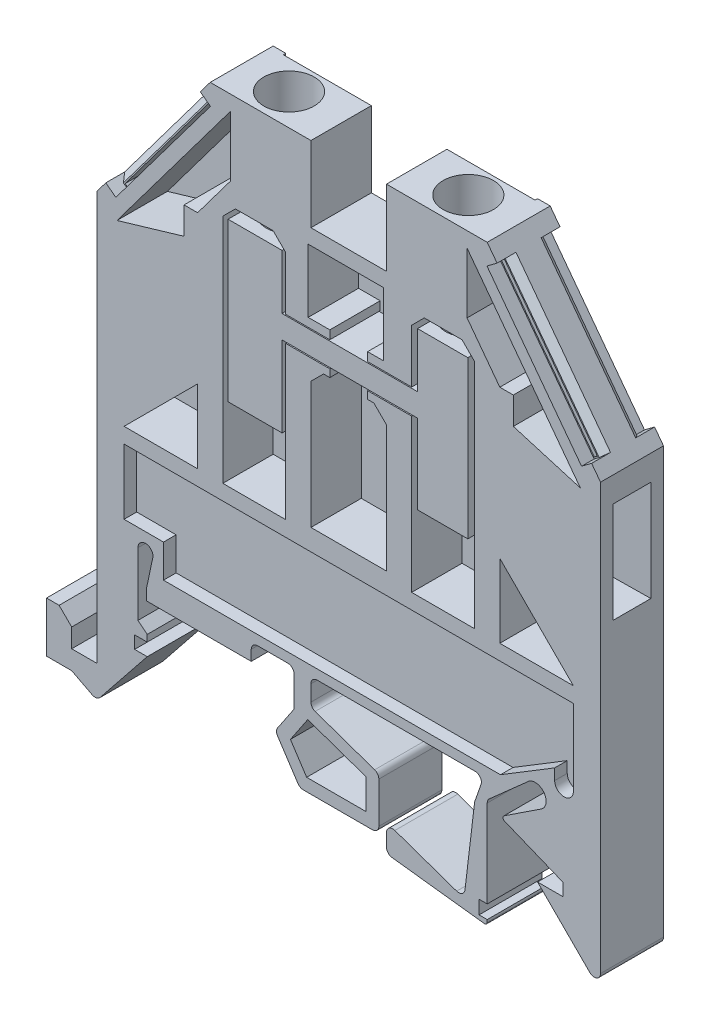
SolidWorks part; units mm, degrees
ref_plane "Front Plane" through (0, 0, 0) normal (0, 0, 1) x (1, 0, 0)
ref_plane "Top Plane" through (0, 0, 0) normal (0, 1, 0) x (1, 0, 0)
ref_plane "Right Plane" through (0, 0, 0) normal (1, 0, 0) x (0, 0, -1)
sketch "Sketch2" plane through (0, 0, 0) normal (0, 0, 1) x (1, 0, 0)
  line L0 (0, 2.5417) -> (0, 35)
  line L1 (0, 2.5417) -> (-2, 2.5417)
  line L2 (-2, 2.5417) -> (-2, 4.0417)
  line L3 (-2, 4.0417) -> (-3, 5.0334)
  line L4 (-3, 5.0334) -> (-4, 5.0334)
  line L5 (0, 35) -> (9, 47)
  line L6 (-4, 5.0334) -> (-4, 1.0334)
  line L7 (0.256, 0.3199) -> (4, 5)
  line L8 (-4, 1.0334) -> (-2, 1.0334)
  line L9 (-2, 1.0334) -> (-0.364, 0.1881)
  line L10 (17, 47) -> (9, 47)
  line L11 (4, 5) -> (3, 5)
  line L12 (20, -16) -> (20, 41) construction
  line L13 (3, 5) -> (3, 6)
  line L14 (17, 47) -> (17, 41)
  line L15 (3, 6) -> (4, 6)
  line L16 (40, 35) -> (31, 47)
  line L17 (4, 6) -> (4, 6.5321)
  line L18 (4, 6.5321) -> (3.2603, 7.1239)
  line L19 (3.2603, 7.1239) -> (3.2603, 12.1239)
  line L20 (35, 5) -> (39.1464, 0.8536)
  line L21 (40, 1.2071) -> (40, 35)
  line L22 (31, 47) -> (23, 47)
  line L23 (4.46, 12.1239) -> (3.9301, 9.6125)
  line L24 (17, 41) -> (23, 41)
  line L25 (23, 41) -> (23, 47)
  line L26 (12.2589, 9.6338) -> (12.2589, 8.8035)
  line L27 (12.2589, 8.8035) -> (3.9301, 8.8035)
  line L28 (3.9301, 8.8035) -> (3.9301, 9.6125)
  line L34 (37, 6) -> (32.3786, 7.8746)
  line L35 (35, 5) -> (37, 5)
  line L36 (37, 5) -> (37, 6)
  line L37 (32.3438, 8.2269) -> (35.2891, 10.1665)
  line L39 (34.3364, 11.6133) -> (31.1682, 8.8035)
  line L40 (31, 8.4294) -> (31, 1.4913)
  line L41 (31, 1.4913) -> (30.3546, 1.4913)
  line L42 (30.3546, 1.4913) -> (30.3546, 0.4168)
  line L43 (30.3546, 0.4168) -> (31, 0.4168)
  line L44 (31, 0.4168) -> (31, 0.2253)
  line L45 (30.7763, 0.0267) -> (23.4408, 0.9015)
  line L46 (23, 1.398) -> (23, 2.406)
  line L47 (23.6652, 2.8779) -> (28.5729, 1.1599)
  line L48 (29.2346, 1.5726) -> (30.0032, 8.0176)
  line L49 (30.0032, 8.0176) -> (30.5111, 9.4686)
  line L50 (30.0392, 10.1338) -> (17.5, 10.1338)
  line L51 (17, 9.6338) -> (17, 8.3723)
  line L52 (17.3348, 7.9004) -> (22.0586, 6.2468)
  line L53 (22.3934, 5.7749) -> (22.3934, 2.5324)
  line L54 (21.8934, 2.0324) -> (16.3919, 2.0324)
  line L55 (15.9743, 2.2574) -> (14.3511, 4.7222)
  line L56 (14.3537, 5.2761) -> (15.664, 7.2264)
  line L57 (15.664, 7.2264) -> (15.664, 9.6338)
  line L58 (15.164, 10.1338) -> (12.7589, 10.1338)
  arc A0 (4.46, 12.1239) -> (3.2603, 12.1239) centre (3.8601, 12.1239) ccw
  arc A1 (35.2891, 10.1665) -> (34.3364, 11.6133) centre (34.8128, 10.8899) ccw
  arc A2 (32.3786, 7.8746) -> (32.3438, 8.2269) centre (32.4538, 8.0599) cw
  arc A3 (31, 0.2253) -> (30.7763, 0.0267) centre (30.8, 0.2253) cw
  arc A4 (23.4408, 0.9015) -> (23, 1.398) centre (23.5, 1.398) cw
  arc A5 (23, 2.406) -> (23.6652, 2.8779) centre (23.5, 2.406) cw
  arc A6 (28.5729, 1.1599) -> (29.2346, 1.5726) centre (28.7381, 1.6318) ccw
  arc A7 (30.5111, 9.4686) -> (30.0392, 10.1338) centre (30.0392, 9.6338) ccw
  arc A8 (31.1682, 8.8035) -> (31, 8.4294) centre (31.5, 8.4294) ccw
  arc A9 (22.0586, 6.2468) -> (22.3934, 5.7749) centre (21.8934, 5.7749) cw
  arc A10 (22.3934, 2.5324) -> (21.8934, 2.0324) centre (21.8934, 2.5324) cw
  arc A11 (16.3919, 2.0324) -> (15.9743, 2.2574) centre (16.3919, 2.5324) cw
  arc A12 (14.3511, 4.7222) -> (14.3537, 5.2761) centre (14.7687, 4.9972) cw
  arc A13 (17, 8.3723) -> (17.3348, 7.9004) centre (17.5, 8.3723) ccw
  arc A14 (15.664, 9.6338) -> (15.164, 10.1338) centre (15.164, 9.6338) ccw
  arc A15 (17.5, 10.1338) -> (17, 9.6338) centre (17.5, 9.6338) ccw
  arc A16 (12.7589, 10.1338) -> (12.2589, 9.6338) centre (12.7589, 9.6338) ccw
  arc A17 (-0.364, 0.1881) -> (0.256, 0.3199) centre (-0.1345, 0.6323) ccw
  arc A18 (39.1464, 0.8536) -> (40, 1.2071) centre (39.5, 1.2071) ccw
  point P91 (0, 0)
  point P94 (40, 0)
  dimension "D21" = 0.2
  dimension "D22" = 0.5
  dimension "D23" = 0.5
  dimension "D24" = 0.5
  dimension "D25" = 0.5
  dimension "D2" = 8
  dimension "D3" = 12
  dimension "D4" = 20
  dimension "D5" = 5
  dimension "D6" = 2
  dimension "D7" = 4
  dimension "D8" = 1
  dimension "D9" = 2
  dimension "D10" = 4
  dimension "D11" = 5
  dimension "D12" = 5
  dimension "D13" = 6
  dimension "D14" = 3
  dimension "D15" = 6
  dimension "D16" = 4
  dimension "D17" = 17
  dimension "D18" = 17
  dimension "D19" = 5
  dimension "D20" = 1
extrude "Extrude1" add sketch "Sketch2" along normal blind 5
sketch "Sketch5" plane through (0, 0, 5) normal (0, 0, 1) x (1, 0, 0)
  line L0 (15, 38.2967) -> (14, 39.2967)
  line L1 (11, 39.2967) -> (10, 38.2967)
  line L2 (21.5, 34.7279) -> (22.7826, 34.7279)
  line L3 (26, 39.2967) -> (25, 38.2967)
  line L4 (29, 39.2967) -> (30, 38.2967)
  line L5 (18.5, 31.4439) -> (18.5, 32.0439)
  line L6 (21.5, 34.7279) -> (21.5, 34.0439)
  line L7 (21.5, 31.4439) -> (22, 31.4439)
  line L8 (18.5, 34.0439) -> (15, 34.0439)
  line L9 (18.5, 32.0439) -> (15, 32.0439)
  line L10 (18.5, 34.0439) -> (18.5, 34.7279)
  line L11 (15, 32.0439) -> (15, 19.921)
  line L12 (21.5, 32.0439) -> (25, 32.0439)
  line L13 (21.5, 34.0439) -> (25, 34.0439)
  line L14 (8, 19.921) -> (2.1599, 19.921)
  line L15 (16.7826, 39.7634) -> (22.7826, 39.7634)
  line L16 (16.7826, 39.7634) -> (16.7826, 34.7279)
  line L17 (16.7826, 34.7279) -> (18.5, 34.7279)
  line L18 (22.7826, 39.7634) -> (22.7826, 34.7279)
  line L19 (18, 31.4439) -> (18.5, 31.4439)
  line L20 (17, 30.4439) -> (17, 20.3877)
  line L21 (17, 20.3877) -> (23, 20.3877)
  line L22 (23, 30.4439) -> (23, 20.3877)
  line L23 (14, 39.2967) -> (11, 39.2967)
  line L24 (15, 38.2967) -> (15, 34.0439)
  line L25 (15, 19.921) -> (10, 19.921)
  line L26 (10, 38.2967) -> (10, 19.921)
  line L27 (2.1599, 19.921) -> (8, 25.7612)
  line L28 (8, 25.7612) -> (8, 19.921)
  line L29 (20, 41) -> (20, 10.1338) construction
  line L30 (23, 41) -> (17, 41) construction
  line L31 (17.5, 10.1338) -> (30.0392, 10.1338) construction
  line L32 (32, 25.7612) -> (32, 19.921)
  line L33 (37.8401, 19.921) -> (32, 25.7612)
  line L34 (30, 38.2967) -> (30, 19.921)
  line L35 (25, 19.921) -> (30, 19.921)
  line L36 (25, 38.2967) -> (25, 34.0439)
  line L37 (26, 39.2967) -> (29, 39.2967)
  line L38 (32, 19.921) -> (37.8401, 19.921)
  line L39 (25, 32.0439) -> (25, 19.921)
  line L40 (21.5, 32.0439) -> (21.5, 31.4439)
  line L41 (17, 30.4439) -> (18, 31.4439)
  line L42 (22, 31.4439) -> (23, 30.4439)
  line L44 (10.6, 45.8) -> (10.6, 41)
  line L45 (10.6, 45.8) -> (1.6, 33.8)
  line L46 (10.6, 41) -> (8, 37.5333)
  line L47 (8, 37.5333) -> (6.9248, 37.5333)
  line L48 (6.9248, 37.5333) -> (6.9248, 35.3744)
  line L49 (6.9248, 35.3744) -> (1.6, 33.8)
  line L50 (33.0752, 35.3744) -> (38.4, 33.8)
  line L51 (33.0752, 37.5333) -> (33.0752, 35.3744)
  line L52 (32, 37.5333) -> (33.0752, 37.5333)
  line L53 (29.4, 41) -> (32, 37.5333)
  line L54 (29.4, 45.8) -> (38.4, 33.8)
  line L55 (29.4, 45.8) -> (29.4, 41)
  point P15 (17, 31.4439)
  point P18 (23, 31.4439)
  point P19 (15, 39.2967)
  point P22 (10, 39.2967)
  point P35 (30, 39.2967)
  point P38 (25, 39.2967)
extrude "Extrude2" cut sketch "Sketch5" against normal blind 4
sketch "Sketch6" plane through (0, 0, 5) normal (0, 0, 1) x (1, 0, 0)
  line L0 (2.1599, 18.7051) -> (37.8401, 18.7051)
  line L1 (37.8401, 18.7051) -> (37.8401, 12.6536)
  line L3 (36.3561, 12.6536) -> (36.3561, 13.5277)
  line L4 (36.3561, 13.5277) -> (32.0528, 10.9054)
  line L5 (32.0528, 10.9054) -> (5.2919, 10.9054)
  line L6 (5.2919, 10.9054) -> (5.2919, 13.5277)
  line L7 (5.2919, 13.5277) -> (2.1599, 13.5277)
  line L8 (2.1599, 13.5277) -> (2.1599, 18.7051)
  arc A0 (36.3561, 12.6536) -> (37.8401, 12.6536) centre (37.0981, 12.6536) ccw
extrude "Extrude3" cut sketch "Sketch6" against normal blind 1
sketch "Sketch7" plane through (0, 0, 0) normal (-1, 0, 0) x (0, 0, 1)
  line L0 (5, 35) -> (0, 35) construction
  line L1 (1, 33) -> (4, 33)
  line L2 (1, 33) -> (1, 25)
  line L3 (1, 25) -> (4, 25)
  line L4 (4, 33) -> (4, 25)
  line L5 (5, 35) -> (5, 2.5417) construction
  dimension "D1" = 8
  dimension "D2" = 2
  dimension "D3" = 3
  dimension "D4" = 1
sketch "Sketch8" plane through (10, 0, 0) normal (1, 0, 0) x (0, 0, -1)
  line L0 (0, 1.2071) -> (0, 35) construction
  line L1 (-3.5, 32.2675) -> (-2, 32.2675)
  line L2 (-3.5, 32.2675) -> (-3.5, 25.8536)
  line L3 (-3.5, 25.8536) -> (-2, 25.8536)
  line L4 (-2, 32.2675) -> (-2, 25.8536)
  dimension "D1" = 2
  dimension "D2" = 1.5
loft "Cut-Loft1" cut profiles "Sketch7", "Sketch8"
sketch "Sketch10" plane through (0, 0, 1) normal (0, 0, 1) x (1, 0, 0)
  line L0 (25.4674, 32.138) -> (25.4674, 25.8312)
  line L1 (10.4198, 38.2967) -> (14.7073, 38.2967)
  line L2 (10.4198, 38.2967) -> (10.4198, 25.74)
  line L3 (10.4198, 25.74) -> (14.7073, 25.74)
  line L4 (14.7073, 38.2967) -> (14.7073, 33.9557)
  line L5 (14.7073, 33.9557) -> (25.4674, 33.9557)
  line L7 (14.7073, 32.138) -> (25.4674, 32.138)
  line L8 (14.7073, 32.138) -> (14.7073, 25.74)
  line L9 (25.4674, 38.2967) -> (29.4612, 38.2967)
  line L10 (25.4674, 38.2967) -> (25.4674, 33.9557)
  line L11 (25.4674, 25.8312) -> (29.4612, 25.8312)
  line L12 (29.4612, 38.2967) -> (29.4612, 25.8312)
extrude "Extrude4" add sketch "Sketch10" along normal blind 4
sketch "Sketch11" plane through (0, 47, 0) normal (0, 1, 0) x (1, 0, 0)
  circle A0 centre (12.7589, -2.5) radius 2
  circle A1 centre (27, -2.5) radius 2
extrude "Extrude5" cut sketch "Sketch11" against normal blind 8.5
sketch "Sketch12" plane through (0, 38.5, 0) normal (0, 1, 0) x (1, 0, 0)
  circle A0 centre (12.7589, -2.5) radius 1.8
  circle A1 centre (27, -2.5) radius 1.8
extrude "Extrude6" add sketch "Sketch12" along normal blind 2
sketch "Sketch13" plane through (0, 40.5, 0) normal (0, 1, 0) x (1, 0, 0)
  line L0 (12.4618, -0.7247) -> (12.4618, -4.2753)
  line L1 (13.0561, -0.7247) -> (13.0561, -4.2753)
  line L2 (20, 0) -> (20, -5) construction
  line L3 (23, 0) -> (17, 0) construction
  line L4 (23, -5) -> (17, -5) construction
  line L5 (26.9439, -0.7247) -> (26.9439, -4.2753)
  line L6 (27.5382, -0.7247) -> (27.5382, -4.2753)
  arc A0 (13.7539, -1) -> (11.7639, -1) centre (12.7589, -2.5) ccw construction
  circle A1 centre (12.7589, -2.5) radius 1.8 construction
  arc A2 (13.0561, -0.7247) -> (12.4618, -0.7247) centre (12.7589, -2.5) ccw
  arc A3 (13.0561, -4.2753) -> (12.4618, -4.2753) centre (12.7589, -3.1721) cw
  arc A4 (26.9439, -4.2753) -> (27.5382, -4.2753) centre (27.2411, -3.1721) ccw
  arc A5 (26.9439, -0.7247) -> (27.5382, -0.7247) centre (27.2411, -2.5) cw
extrude "Extrude7" cut sketch "Sketch13" against normal blind 1
sketch "Sketch14" plane through (-16.8, 12.6, 0) normal (-0.8, 0.6, 0) x (0, 0, 1)
  line L0 (0, 43) -> (0, 28) construction
  line L1 (0, 41.6959) -> (1, 41.6959)
  line L2 (0, 41.6959) -> (0, 29.1789)
  line L3 (0, 29.1789) -> (1, 29.1789)
  line L4 (1, 41.6959) -> (1, 29.1789)
  line L5 (5, 43) -> (5, 28) construction
  line L6 (5, 41.6959) -> (4, 41.6959)
  line L7 (5, 41.6959) -> (5, 29.1789)
  line L8 (5, 29.1789) -> (4, 29.1789)
  line L9 (4, 41.6959) -> (4, 29.1789)
  dimension "D1" = 1
  dimension "D2" = 1
extrude "Extrude8" cut sketch "Sketch14" against normal blind 1
chamfer "Chamfer1" distance 0.5 angle 45 2 edges at (4.4624, 40.9499, 1) (4.4624, 40.9499, 4)
sketch "Sketch17" plane through (0, 0, 4) normal (0, 0, 1) x (1, 0, 0)
  line L0 (8.6375, 45.5167) -> (1.2473, 35.6631)
  line L1 (1.2473, 35.6631) -> (1.4873, 35.4831)
  line L2 (1.4873, 35.4831) -> (8.8775, 45.3367)
  line L3 (8.8775, 45.3367) -> (8.6375, 45.5167)
extrude "Extrude9" cut sketch "Sketch17" against normal blind 1
sketch "Sketch18" plane through (0, 0, 1) normal (0, 0, -1) x (-1, 0, 0)
  line L0 (-1.2473, 35.6631) -> (-8.6375, 45.5167)
  line L1 (-8.6375, 45.5167) -> (-8.8775, 45.3367)
  line L2 (-8.8775, 45.3367) -> (-1.4873, 35.4831)
  line L3 (-1.4873, 35.4831) -> (-1.2473, 35.6631)
extrude "Extrude10" cut sketch "Sketch18" against normal blind 1
sketch "Sketch19" plane through (0, 0, 5) normal (0, 0, 1) x (1, 0, 0)
  line L5 (16.4941, 6.6688) -> (16.7478, 7.0464)
  line L10 (16.4941, 6.6688) -> (15.3692, 4.9945)
  line L11 (15.3692, 4.9945) -> (16.6613, 3.0324)
  line L12 (16.6613, 3.0324) -> (21.3934, 3.0324)
  line L13 (21.3934, 3.0324) -> (21.3934, 5.4201)
  line L14 (21.3934, 5.4201) -> (16.7478, 7.0464)
extrude "Extrude11" cut sketch "Sketch19" against normal through all
ref_plane "Plane1" through (20, 0, 0) normal (-1, 0, 0) x (0, 0, 1)
mirror "Mirror4" about plane through (20, 0, 0) normal (-1, 0, 0) of "Cut-Loft1", "Extrude8", "Extrude9", "Extrude10"
chamfer "Chamfer2" distance 0.5 angle 45 2 edges at (35.5376, 40.9499, 1) (35.5376, 40.9499, 4)
sketch "Sketch20" plane through (0, 0, 0) normal (0, 0, -1) x (-1, 0, 0)
  line L0 (-37.8401, 18.7051) -> (-2.1599, 18.7051)
  line L1 (-2.1599, 18.7051) -> (-2.1599, 13.5277)
  line L2 (-2.1599, 13.5277) -> (-5.2919, 13.5277)
  line L3 (-5.2919, 13.5277) -> (-5.2919, 10.9054)
  line L4 (-5.2919, 10.9054) -> (-32.0528, 10.9054)
  line L5 (-32.0528, 10.9054) -> (-36.3561, 13.5277)
  line L6 (-36.3561, 13.5277) -> (-36.3561, 12.6536)
  line L8 (-37.8401, 12.6536) -> (-37.8401, 18.7051)
  arc A0 (-36.3561, 12.6536) -> (-37.8401, 12.6536) centre (-37.0981, 12.6536) cw
extrude "Extrude12" cut sketch "Sketch20" against normal blind 1
sketch "Sketch21" plane through (0, 0, 0) normal (0, 0, -1) x (-1, 0, 0)
  line L0 (-30, 47) -> (-30, 37)
  line L1 (-31, 47) -> (-23, 47) construction
  line L2 (-30, 37) -> (-25, 32)
  line L3 (-25, 32) -> (-15, 32)
  line L4 (-15, 32) -> (-10, 37.4646)
  line L5 (-10, 37.4646) -> (-10, 47)
  line L6 (-17, 47) -> (-9, 47) construction
  line L7 (-17, 41) -> (-17, 47) construction
  line L8 (-23, 47) -> (-23, 41) construction
  line L9 (-10, 47) -> (-30, 47)
  dimension "D1" = 7
  dimension "D2" = 7
  dimension "D3" = 10
  dimension "D4" = 15
  dimension "D5" = 2
  dimension "D6" = 2
extrude "Extrude13" cut sketch "Sketch21" against normal blind 0.2
